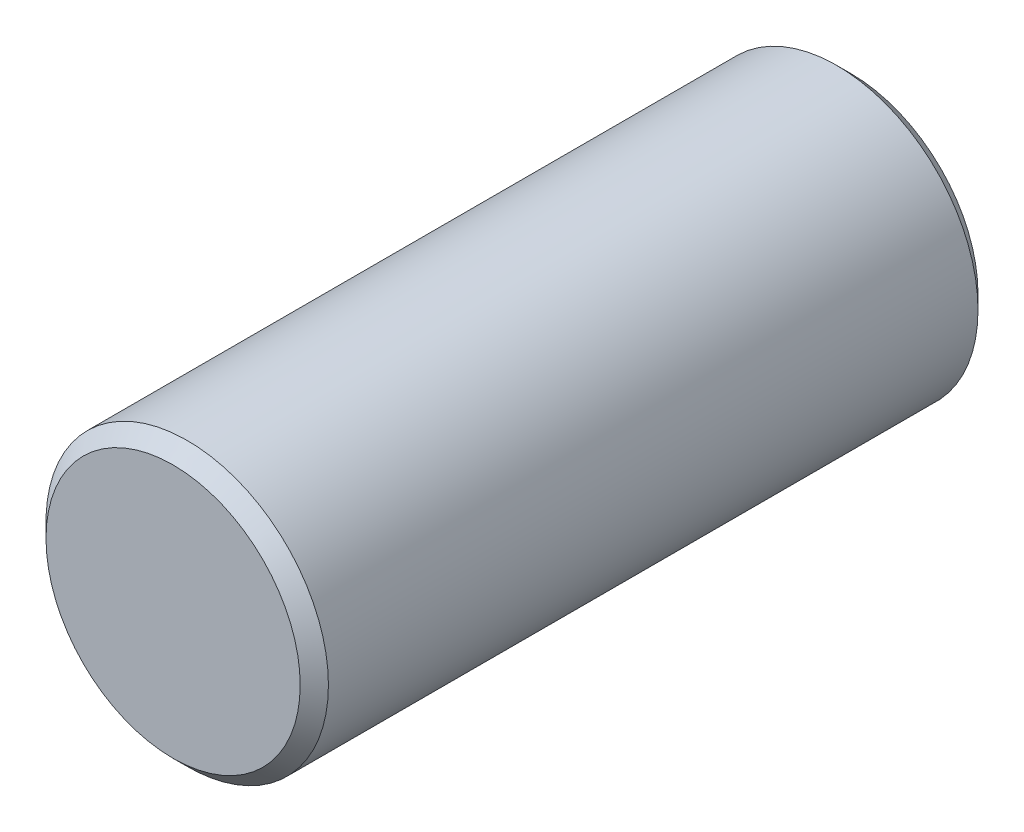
SolidWorks part; units mm, degrees
ref_plane "Plan de face" through (0, 0, 0) normal (0, 0, 1) x (1, 0, 0)
ref_plane "Plan de dessus" through (0, 0, 0) normal (0, 1, 0) x (1, 0, 0)
ref_plane "Plan de droite" through (0, 0, 0) normal (1, 0, 0) x (0, 0, -1)
sketch "Esquisse1" plane through (0, 0, 0) normal (0, 0, 1) x (1, 0, 0)
  circle A0 centre (0, 0) radius 2.5
  dimension "D1" = 5
extrude "Boss.-Extru.1" add sketch "Esquisse1" along normal blind 12
chamfer "Chanfrein1" distance 0.25 angle 45 2 edges at (2.5, 0, 12) (2.5, 0, 0)
